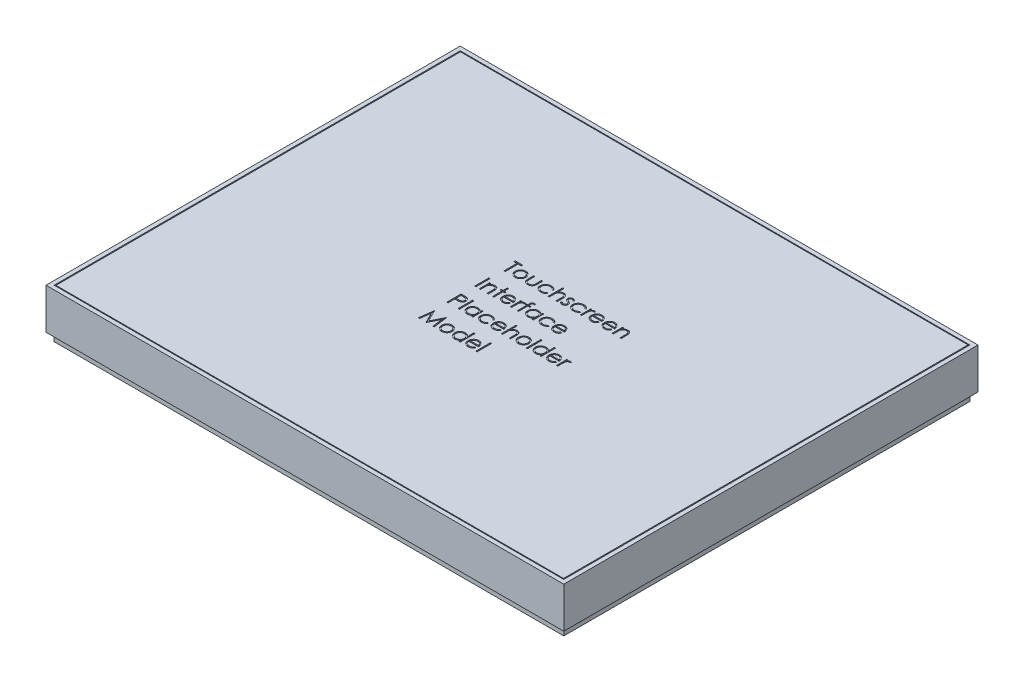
SolidWorks part; units mm, degrees
ref_plane "Front Plane" through (0, 0, 0) normal (0, 0, 1) x (1, 0, 0)
ref_plane "Top Plane" through (0, 0, 0) normal (0, 1, 0) x (1, 0, 0)
ref_plane "Right Plane" through (0, 0, 0) normal (1, 0, 0) x (0, 0, -1)
sketch "Sketch1" plane through (0, 0, 0) normal (0, 1, 0) x (1, 0, 0)
  line L1 (63.5, -50.8) -> (-63.5, -50.8)
  line L2 (63.5, -50.8) -> (63.5, 50.8)
  line L3 (63.5, 50.8) -> (-63.5, 50.8)
  line L4 (-63.5, -50.8) -> (-63.5, 50.8)
  line L5 (63.5, -50.8) -> (-63.5, 50.8) construction
  line L6 (63.5, 50.8) -> (-63.5, -50.8) construction
  point P0 (0, 0)
  dimension "D1" = 101.6
  dimension "D2" = 127
extrude "Boss-Extrude1" add sketch "Sketch1" along normal blind 10
sketch "Sketch2" plane through (0, 0, 0) normal (0, -1, 0) x (1, 0, 0)
  line L0 (-63.5, -50.8) -> (-63.5, 50.8) construction
  line L1 (62.5, -49.8) -> (-62.5, -49.8)
  line L2 (62.5, -49.8) -> (62.5, 49.8)
  line L3 (62.5, 49.8) -> (-62.5, 49.8)
  line L4 (-62.5, -49.8) -> (-62.5, 49.8)
  line L5 (62.5, -49.8) -> (-62.5, 49.8) construction
  line L6 (62.5, 49.8) -> (-62.5, -49.8) construction
  line L7 (-63.5, 50.8) -> (63.5, 50.8) construction
  point P0 (0, 0)
  dimension "D1" = 1
  dimension "D2" = 1
extrude "Boss-Extrude2" add sketch "Sketch2" along normal blind 2
sketch "Sketch3" plane through (0, 10, 0) normal (0, 1, 0) x (1, 0, 0)
  line L0 (63.5, 50.8) -> (-63.5, 50.8) construction
  line L1 (62.5, -49.8) -> (-62.5, -49.8)
  line L2 (62.5, -49.8) -> (62.5, 49.8)
  line L3 (62.5, 49.8) -> (-62.5, 49.8)
  line L4 (-62.5, -49.8) -> (-62.5, 49.8)
  line L5 (62.5, -49.8) -> (-62.5, 49.8) construction
  line L6 (62.5, 49.8) -> (-62.5, -49.8) construction
  line L7 (62.25, -49.6008) -> (-62.25, -49.6008)
  line L8 (62.25, -49.6008) -> (62.25, 49.6008)
  line L9 (62.25, 49.6008) -> (-62.25, 49.6008)
  line L10 (-62.25, -49.6008) -> (-62.25, 49.6008)
  line L11 (62.25, -49.6008) -> (-62.25, 49.6008) construction
  line L12 (62.25, 49.6008) -> (-62.25, -49.6008) construction
  line L13 (-63.5, 50.8) -> (-63.5, -50.8) construction
  point P0 (0, 0)
  point P6 (0, 0)
  dimension "D1" = 1
  dimension "D2" = 1
  dimension "D3" = 0.25
extrude "Cut-Extrude1" cut sketch "Sketch3" against normal blind 0.25
sketch "Sketch4" plane through (0, 10, 0) normal (0, 1, 0) x (1, 0, 0)
  text T0 "Touchscreen  Interface  Placeholder  Model"
extrude "Cut-Extrude2" cut sketch "Sketch4" against normal blind 0.25
